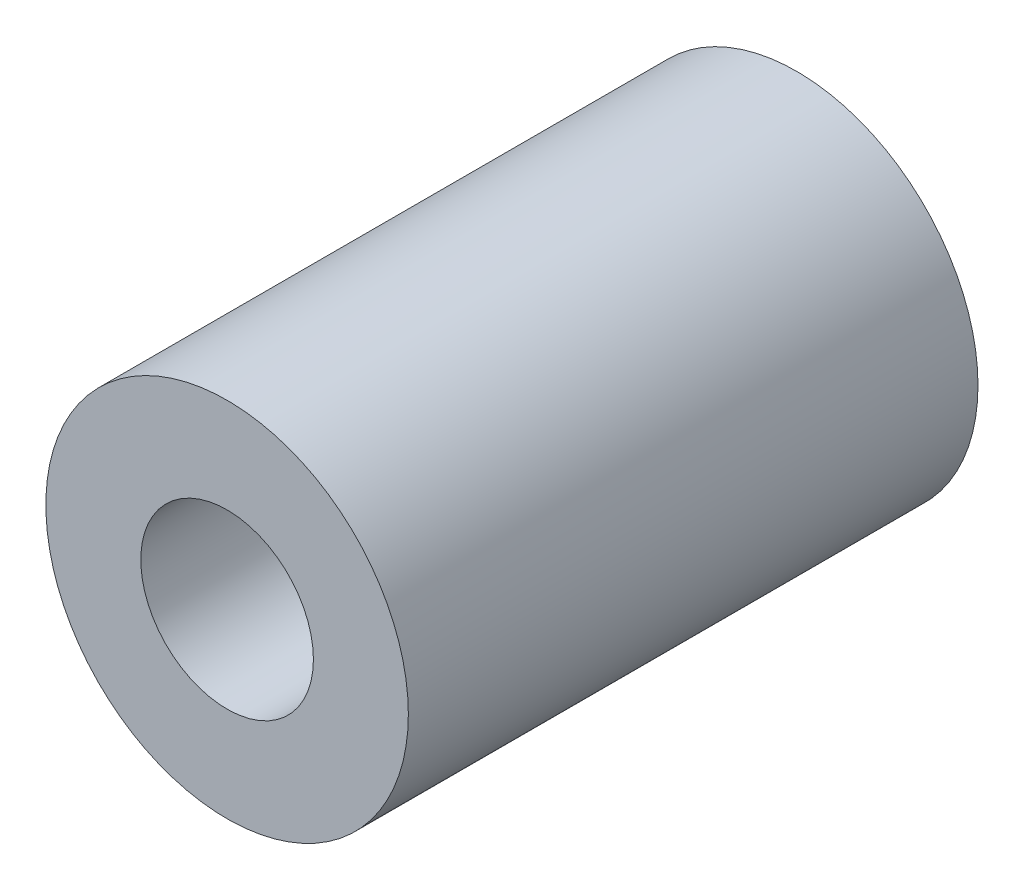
SolidWorks part; units mm, degrees
ref_plane "Plan de face" through (0, 0, 0) normal (0, 0, 1) x (1, 0, 0)
ref_plane "Plan de dessus" through (0, 0, 0) normal (0, 1, 0) x (1, 0, 0)
ref_plane "Plan de droite" through (0, 0, 0) normal (1, 0, 0) x (0, 0, -1)
sketch "Esquisse1" plane through (0, 0, 0) normal (0, 0, 1) x (1, 0, 0)
  circle A0 centre (0, 0) radius 10.5
  circle A1 centre (0, 0) radius 5
  dimension "D1" = 21
  dimension "D2" = 10
extrude "Boss.-Extru.1" add sketch "Esquisse1" along normal blind 33
